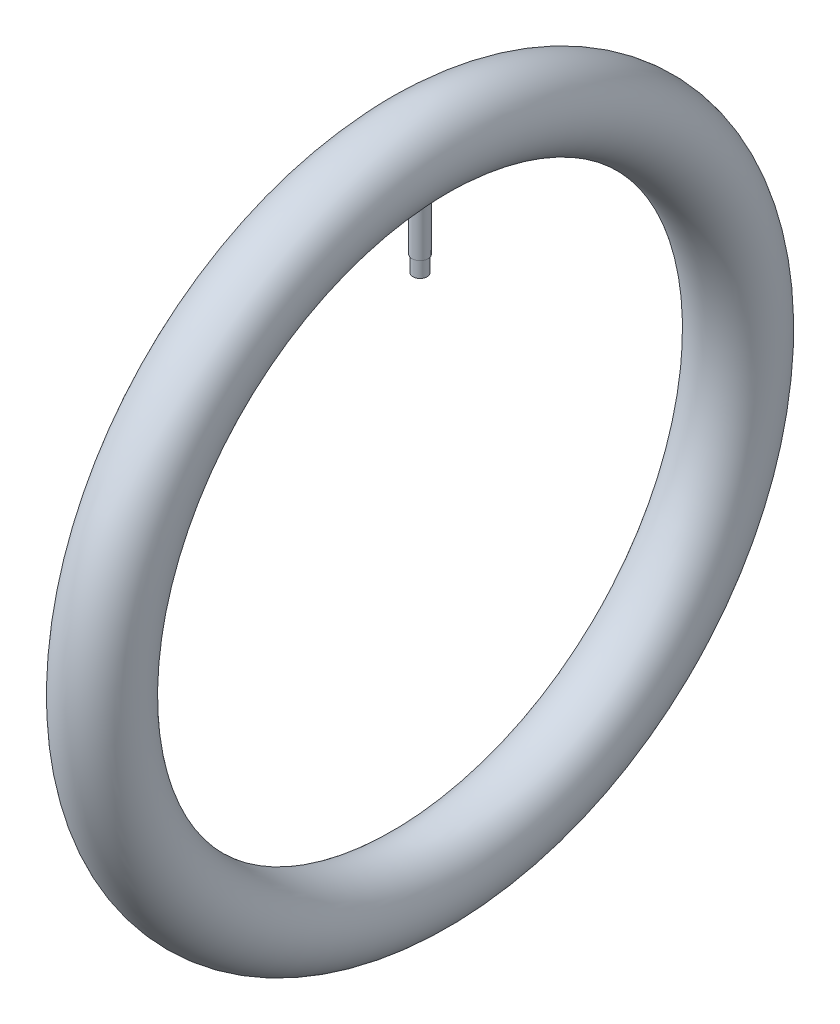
SolidWorks part; units mm, degrees
ref_plane "Plan de face" through (0, 0, 0) normal (0, 0, 1) x (1, 0, 0)
ref_plane "Plan de dessus" through (0, 0, 0) normal (0, 1, 0) x (1, 0, 0)
ref_plane "Plan de droite" through (0, 0, 0) normal (1, 0, 0) x (0, 0, -1)
sketch "Esquisse1" plane through (0, 0, 0) normal (0, 0, 1) x (1, 0, 0)
  line L0 (0, 0) -> (26.4297, 0) construction
  circle A0 centre (0, 178) radius 22
  circle A1 centre (0, 178) radius 21
  dimension "D1" = 44
  dimension "D2" = 42
  dimension "D3" = 178
revolve "Révolution1" add sketch "Esquisse1" angle 360 about L0
ref_plane "Plan1" through (0, 116, 0) normal (0, 1, 0) x (-1, 0, 0)
sketch "Esquisse2" plane through (0, 116, 0) normal (0, 1, 0) x (-1, 0, 0)
  circle A0 centre (0, 0) radius 4.5
  dimension "D1" = 9
extrude "Extrusion1" add sketch "Esquisse2" along normal up to surface (39.9351 mm away)
fillet "Congé1" radius 2 1 edges at (2.2797, 156.0702, 3.8798)
sketch "Esquisse3" plane through (0, 116, 0) normal (0, -1, 0) x (1, 0, 0)
  circle A0 centre (0, 0) radius 4
  circle A1 centre (0, 0) radius 4.5
  dimension "D1" = 8
  dimension "D2" = 9
extrude "Enlèv. mat.-Extru.1" cut sketch "Esquisse3" against normal blind 9
sketch "Esquisse4" plane through (0, 116, 0) normal (0, -1, 0) x (1, 0, 0)
  circle A0 centre (0, 0) radius 3.25
  dimension "D1" = 6.5
extrude "Enlèv. mat.-Extru.2" cut sketch "Esquisse4" against normal blind 50
